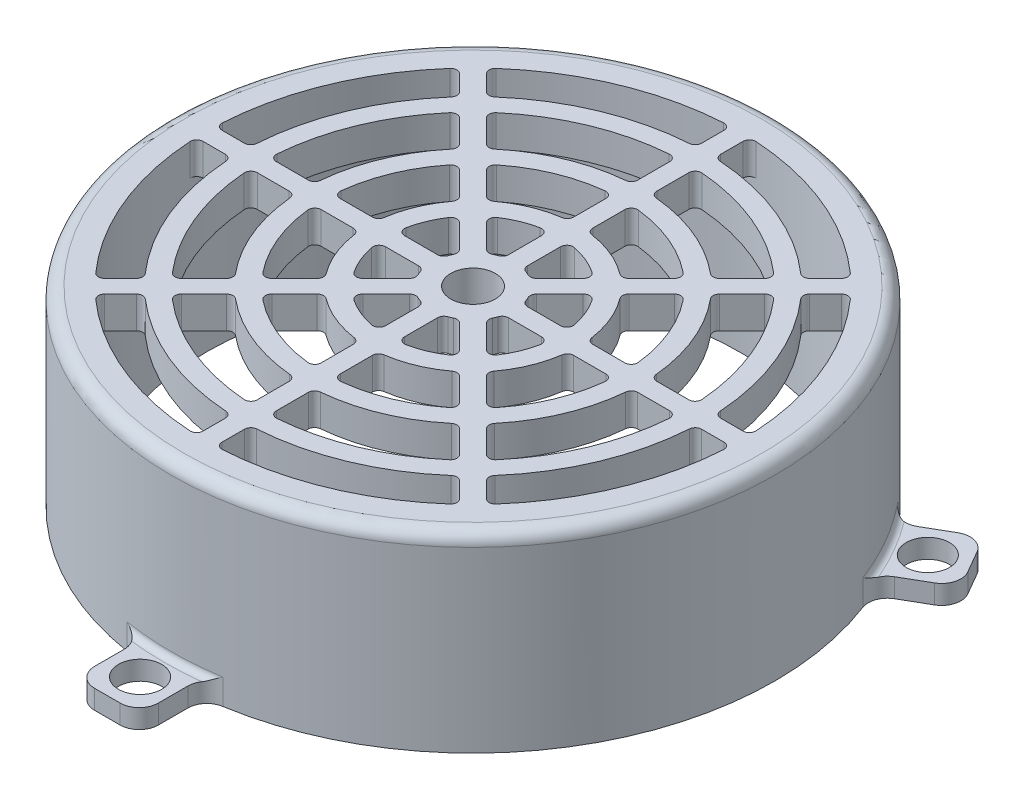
SolidWorks part; units mm, degrees
ref_plane "Front" through (0, 0, 0) normal (0, 0, 1) x (1, 0, 0)
ref_plane "Top" through (0, 0, 0) normal (0, 1, 0) x (1, 0, 0)
ref_plane "Right" through (0, 0, 0) normal (1, 0, 0) x (0, 0, -1)
sketch "Sketch1" plane through (0, 0, 0) normal (0, 1, 0) x (1, 0, 0)
  circle A0 centre (0, 0) radius 23.725
  circle A1 centre (0, 0) radius 21
  dimension "D1" = 47.45
  dimension "D2" = 42
extrude "Boss-Extrude1" add sketch "Sketch1" along normal mid plane 15
sketch "Sketch2" plane through (0, -7.5, 0) normal (0, -1, 0) x (1, 0, 0)
  line L0 (0, 23.725) -> (0, 28.725) construction
  line L1 (-2.5, 18.725) -> (2.5, 18.725)
  line L2 (-2.5, 18.725) -> (-2.5, 28.725)
  line L3 (-2.5, 28.725) -> (2.5, 28.725)
  line L4 (2.5, 18.725) -> (2.5, 28.725)
  line L5 (-2.5, 18.725) -> (2.5, 28.725) construction
  line L6 (-2.5, 28.725) -> (2.5, 18.725) construction
  circle A0 centre (0, 0) radius 23.725 construction
  circle A2 centre (0, 0) radius 23.725
  circle A3 centre (0, 0) radius 23.725
  point P0 (0, 23.725)
  dimension "D1" = 5
  dimension "D2" = 5
  dimension "D3" = 0
extrude "Boss-Extrude2" add sketch "Sketch2" against normal blind 1.5 contours L4 L3 L2 M5
hole_wizard "M3 Clearance Hole1" positions "Sketch4" profile "Sketch5" hole size "M3" standard "ANSI Metric"
sketch "Sketch4" plane through (0, -7.5, 0) normal (0, -1, 0) x (-1, 0, 0)
  line L0 (2.5, -23.5929) -> (-2.5, -28.725) construction
  point P0 (0, -26.159)
  point P10 (0, -26.159)
sketch "Sketch5" plane through (0, -7.5, 26.159) normal (1, 0, 0) x (0, 0, -1)
  line L0 (0, 0) -> (0, 1.501)
  line L1 (0, 1.501) -> (1.7, 1.501)
  line L2 (1.7, 1.501) -> (1.7, 0)
  line L5 (1.7, 0) -> (0, 0)
  line L11 (0, -6.35) -> (0, 107.95) construction
  dimension "Thru Hole Dia." = 3.4
  dimension "Thru Hole Depth" = 1.501
pattern_circular "CirPattern1" count 3 over 360 about axis through (0, 0, 0) along (0, 1, 0) of "Boss-Extrude2", "M3 Clearance Hole1"
fillet "Fillet2" radius 1.5 12 edges at (2.5, -6.75, 28.725) (-2.5, -6.75, 28.725) (-2.5, -6.75, 23.5929) (2.5, -6.75, 23.5929) (23.6266, -6.75, -16.5276) (19.1821, -6.75, -13.9615) (-19.1821, -6.75, -13.9615) (-23.6266, -6.75, -16.5276) (-26.1266, -6.75, -12.1974) (-21.6821, -6.75, -9.6314) (26.1266, -6.75, -12.1974) (21.6821, -6.75, -9.6314)
fillet "Fillet3" radius 0.5 3 edges at (-20.5465, -6, -11.8625) (20.5465, -6, -11.8625) (0, -6, 23.725)
sketch "Sketch6" plane through (0, 7.5, 0) normal (0, 1, 0) x (1, 0, 0)
  line L0 (0, 21) -> (0, 2.5)
  line L1 (21, 0) -> (2.5, 0)
  line L2 (-14.8492, -14.8492) -> (-1.7678, -1.7678)
  line L3 (-14.8492, 14.8492) -> (-1.7678, 1.7678)
  line L4 (1.7678, -1.7678) -> (14.8492, -14.8492)
  line L5 (1.7678, 1.7678) -> (14.8492, 14.8492)
  line L6 (0, -2.5) -> (0, -21)
  line L7 (-2.5, 0) -> (-21, 0)
  circle A0 centre (0, 0) radius 21 construction
  circle A1 centre (0, 0) radius 2.5
  circle A2 centre (0, 0) radius 7.5
  circle A3 centre (0, 0) radius 12.5
  circle A4 centre (0, 0) radius 17.5
  point P14 (0, 0)
  point P17 (0, 0)
  dimension "D1" = 5
  dimension "D2" = 15
  dimension "D3" = 25
  dimension "D4" = 35
  dimension "D5" = 45
  dimension "D6" = 45
extrude "Extrude-Thin1" add sketch "Sketch6" against normal blind 2.5 thin contours L2 | L7 | L3 | L0 | L5 | L1 | L4 | L6 | A1 | A2 | A3 | A4
fillet "Fillet4" radius 0.5 128 edges at (-6.7082, 6.25, 0.75) (-5.2737, 6.25, 4.2131) (-2.7664, 6.25, 1.7057) (-3.1623, 6.25, 0.75) (-11.726, 6.25, 0.75) (-8.8219, 6.25, 7.7612) (-6.3398, 6.25, 5.2791) (-8.2158, 6.25, 0.75) (-16.7332, 6.25, 0.75) (-12.3625, 6.25, 11.3018) (-9.8845, 6.25, 8.8238) (-13.2288, 6.25, 0.75) (-16.7332, 6.25, -0.75) (-13.2288, 6.25, -0.75) (-9.8845, 6.25, -8.8238) (-12.3625, 6.25, -11.3018) (-11.726, 6.25, -0.75) (-8.2158, 6.25, -0.75) (-6.3398, 6.25, -5.2791) (-6.7082, 6.25, -0.75) (-3.1623, 6.25, -0.75) (-2.7664, 6.25, -1.7057) (-5.2737, 6.25, -4.2131) (-11.3018, 6.25, -12.3625) (-8.8238, 6.25, -9.8845) (-0.75, 6.25, -13.2288) (-0.75, 6.25, -16.7332) (-7.7612, 6.25, -8.8219) (-5.2791, 6.25, -6.3398) (-0.75, 6.25, -8.2158) (-0.75, 6.25, -11.726) (-4.2131, 6.25, -5.2737) (-1.7057, 6.25, -2.7664) (-0.75, 6.25, -3.1623) (-0.75, 6.25, -6.7082) (4.2131, 6.25, -5.2737) (0.75, 6.25, -6.7082) (0.75, 6.25, -3.1623) (1.7057, 6.25, -2.7664) (7.7612, 6.25, -8.8219) (0.75, 6.25, -11.726) (0.75, 6.25, -8.2158) (5.2791, 6.25, -6.3398) (11.3018, 6.25, -12.3625) (0.75, 6.25, -16.7332) (0.75, 6.25, -13.2288) (8.8238, 6.25, -9.8845) (12.3625, 6.25, -11.3018) (9.8845, 6.25, -8.8238) (13.2288, 6.25, -0.75) (16.7332, 6.25, -0.75) (8.8219, 6.25, -7.7612) (6.3398, 6.25, -5.2791) (8.2158, 6.25, -0.75) (11.726, 6.25, -0.75) (5.2737, 6.25, -4.2131) (2.7664, 6.25, -1.7057) (3.1623, 6.25, -0.75) (6.7082, 6.25, -0.75) (5.2737, 6.25, 4.2131) (6.7082, 6.25, 0.75) (3.1623, 6.25, 0.75) (2.7664, 6.25, 1.7057) (8.8219, 6.25, 7.7612) (11.726, 6.25, 0.75) (8.2158, 6.25, 0.75) (6.3398, 6.25, 5.2791) (12.3625, 6.25, 11.3018) (16.7332, 6.25, 0.75) (13.2288, 6.25, 0.75) (9.8845, 6.25, 8.8238) (0.75, 6.25, 6.7082) (4.2131, 6.25, 5.2737) (1.7057, 6.25, 2.7664) (0.75, 6.25, 3.1623) (0.75, 6.25, 11.726) (7.7612, 6.25, 8.8219) (5.2791, 6.25, 6.3398) (0.75, 6.25, 8.2158) (0.75, 6.25, 16.7332) (11.3018, 6.25, 12.3625) (8.8238, 6.25, 9.8845) (0.75, 6.25, 13.2288) (-1.7057, 6.25, 2.7664) (-4.2131, 6.25, 5.2737) (-0.75, 6.25, 6.7082) (-0.75, 6.25, 3.1623) (-5.2791, 6.25, 6.3398) (-7.7612, 6.25, 8.8219) (-0.75, 6.25, 11.726) (-0.75, 6.25, 8.2158) (-8.8238, 6.25, 9.8845) (-11.3018, 6.25, 12.3625) (-0.75, 6.25, 16.7332) (-0.75, 6.25, 13.2288) (12.3635, 6.25, 13.4241) (0.75, 6.25, 18.2346) (0.75, 6.25, 20.9866) (14.3094, 6.25, 15.3701) (-20.9866, 6.25, -0.75) (-18.2346, 6.25, -0.75) (-13.4241, 6.25, -12.3635) (-15.3701, 6.25, -14.3094) (-14.3094, 6.25, -15.3701) (-12.3635, 6.25, -13.4241) (-0.75, 6.25, -18.2346) (-0.75, 6.25, -20.9866) (18.2346, 6.25, 0.75) (13.4241, 6.25, 12.3635) (15.3701, 6.25, 14.3094) (20.9866, 6.25, 0.75) (0.75, 6.25, -20.9866) (0.75, 6.25, -18.2346) (12.3635, 6.25, -13.4241) (14.3094, 6.25, -15.3701) (13.4241, 6.25, -12.3635) (18.2346, 6.25, -0.75) (20.9866, 6.25, -0.75) (15.3701, 6.25, -14.3094) (-13.4241, 6.25, 12.3635) (-18.2346, 6.25, 0.75) (-20.9866, 6.25, 0.75) (-15.3701, 6.25, 14.3094) (-0.75, 6.25, 20.9866) (-0.75, 6.25, 18.2346) (-12.3635, 6.25, 13.4241) (-14.3094, 6.25, 15.3701) (-8.8219, 6.25, -7.7612)
fillet "Fillet5" radius 1 1 edges at (0, 7.5, 23.725)
sketch "Sketch7" plane through (0, -7.5, 0) normal (0, -1, 0) x (1, 0, 0)
  line B0 (20.3191, -14.618) -> (22.3275, -15.7776)
  line B1 (24.3766, -15.2285) -> (25.3766, -13.4965)
  line B2 (24.8275, -11.4474) -> (22.8191, -10.2879)
  line B3 (2.5, 24.9058) -> (2.5, 27.225)
  line B4 (1, 28.725) -> (-1, 28.725)
  line B5 (-2.5, 27.225) -> (-2.5, 24.9058)
  line B6 (-22.8191, -10.2879) -> (-24.8275, -11.4474)
  line B7 (-25.3766, -13.4965) -> (-24.3766, -15.2285)
  line B8 (-22.3275, -15.7776) -> (-20.3191, -14.618)
  circle B9 centre (22.6543, -13.0795) radius 1.7
  circle B10 centre (0, 26.159) radius 1.7
  circle B11 centre (-22.6543, -13.0795) radius 1.7
  arc B12 (22.3275, -15.7776) -> (24.3766, -15.2285) centre (23.0775, -14.4785) ccw
  arc B13 (25.3766, -13.4965) -> (24.8275, -11.4474) centre (24.0775, -12.7465) ccw
  arc B14 (22.1676, -8.4543) -> (22.8191, -10.2879) centre (23.5691, -8.9888) ccw
  arc B15 (22.1676, -8.4543) -> (3.7621, 23.4248) centre (0, 0) ccw
  arc B16 (2.5, 24.9058) -> (3.7621, 23.4248) centre (4, 24.9058) ccw
  arc B17 (2.5, 27.225) -> (1, 28.725) centre (1, 27.225) ccw
  arc B18 (-1, 28.725) -> (-2.5, 27.225) centre (-1, 27.225) ccw
  arc B19 (-3.7621, 23.4248) -> (-2.5, 24.9058) centre (-4, 24.9058) ccw
  arc B20 (-3.7621, 23.4248) -> (-22.1676, -8.4543) centre (0, 0) ccw
  arc B21 (-22.8191, -10.2879) -> (-22.1676, -8.4543) centre (-23.5691, -8.9888) ccw
  arc B22 (-24.8275, -11.4474) -> (-25.3766, -13.4965) centre (-24.0775, -12.7465) ccw
  arc B23 (-24.3766, -15.2285) -> (-22.3275, -15.7776) centre (-23.0775, -14.4785) ccw
  arc B24 (-18.4054, -14.9705) -> (-20.3191, -14.618) centre (-19.5691, -15.917) ccw
  arc B25 (-18.4054, -14.9705) -> (18.4054, -14.9705) centre (0, 0) ccw
  arc B26 (20.3191, -14.618) -> (18.4054, -14.9705) centre (19.5691, -15.917) ccw
sketch_block_instance "Block1-1"
sketch_block "Block1"
